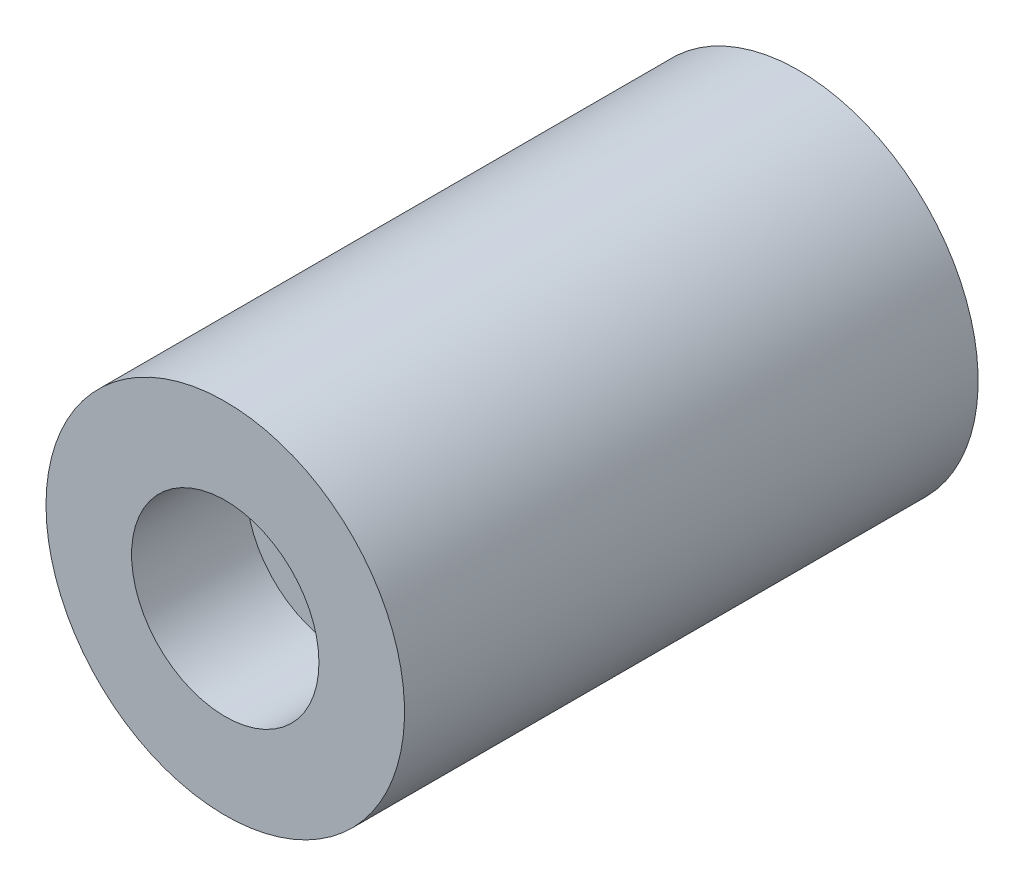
SolidWorks part; units mm, degrees
ref_plane "Front" through (0, 0, 0) normal (0, 0, 1) x (1, 0, 0)
ref_plane "Top" through (0, 0, 0) normal (0, 1, 0) x (1, 0, 0)
ref_plane "Right" through (0, 0, 0) normal (1, 0, 0) x (0, 0, -1)
sketch "Sketch1" plane through (0, 0, 0) normal (0, 0, 1) x (1, 0, 0)
  circle A0 centre (0, 0) radius 2.3812
  dimension "D1" = 4.7625
extrude "Extrude1" add sketch "Sketch1" along normal blind 7.62
sketch "Sketch2" plane through (0, 0, 7.62) normal (0, 0, 1) x (1, 0, 0)
  circle A0 centre (0, 0) radius 1.2446
  dimension "D1" = 2.4892
extrude "Cut-Extrude1" cut sketch "Sketch2" against normal blind 1.524
hole_wizard "#8-32 Tapped Hole1" positions "Sketch4" profile "Sketch3" tap size "#8-32" standard "Ansi Inch"
sketch "Sketch4" plane through (0, 0, 0) normal (0, 0, -1) x (-1, 0, 0)
  point P0 (0, 0)
sketch "Sketch3" plane through (0, 0, 0) normal (1, 0, 0) x (0, 1, 0)
  line L0 (0, 0) -> (0, 5.8638)
  line L1 (0, 5.8638) -> (1.7272, 4.826)
  line L2 (1.7272, 4.826) -> (1.7272, 0)
  line L5 (1.7272, 0) -> (0, 0)
  line L10 (0, 5.8638) -> (-1.7272, 4.826) construction
  line L11 (0, -6.35) -> (0, 107.95) construction
  dimension "Tap Drill Dia." = 3.4544
  dimension "Tap Drill Depth" = 4.826
  dimension "Drill Angle" = 118
